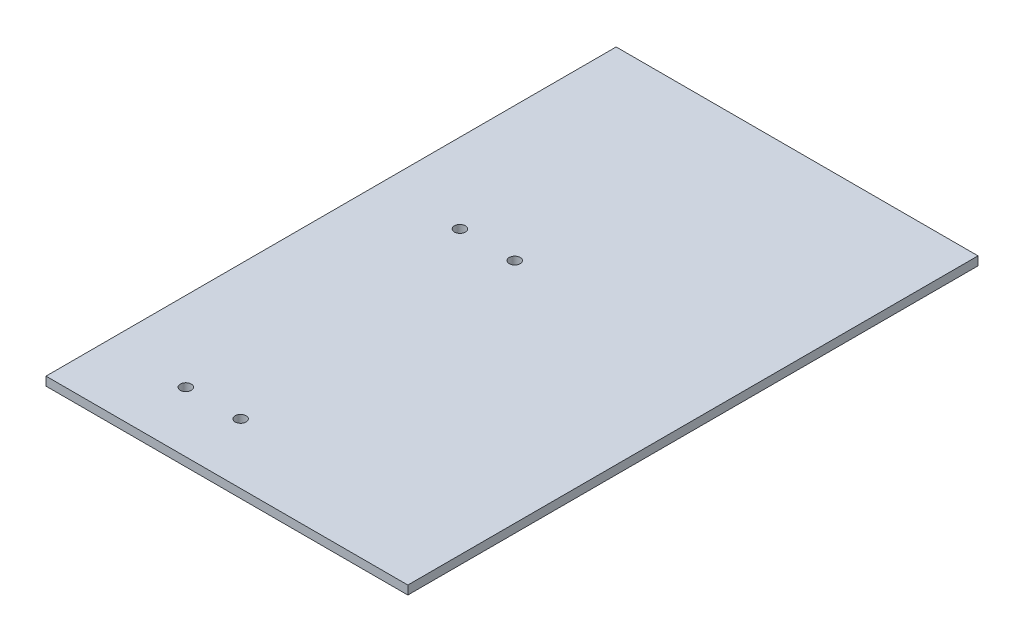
SolidWorks part; units mm, degrees
ref_plane "Plan de face" through (0, 0, 0) normal (0, 0, 1) x (1, 0, 0)
ref_plane "Plan de dessus" through (0, 0, 0) normal (0, 1, 0) x (1, 0, 0)
ref_plane "Plan de droite" through (0, 0, 0) normal (1, 0, 0) x (0, 0, -1)
sketch "Esquisse1" plane through (0, 0, 0) normal (0, 1, 0) x (1, 0, 0)
  line L1 (-33, -52) -> (33, -52)
  line L2 (-33, -52) -> (-33, 52)
  line L3 (-33, 52) -> (33, 52)
  line L4 (33, -52) -> (33, 52)
  line L5 (-33, -52) -> (33, 52) construction
  line L6 (-33, 52) -> (33, -52) construction
  point P0 (0, 0)
  dimension "D1" = 104
  dimension "D2" = 66
extrude "Boss.-Extru.1" add sketch "Esquisse1" along normal blind 1.5875
sketch "Esquisse2" plane through (-33, 0, 0) normal (-1, 0, 0) x (0, 0, 1)
  line L1 (-52, 0) -> (52, 0)
  line L2 (-52, 0) -> (-52, 4)
  line L3 (-52, 4) -> (52, 4)
  line L4 (52, 0) -> (52, 4)
  dimension "D1" = 4
  dimension "D2" = 104
extrude "Boss.-Extru.2" [suppressed] add sketch "Esquisse2" along normal blind 1.5875 contours L3 L4 L1 L2
sketch "Esquisse3" plane through (33, 0, 0) normal (1, 0, 0) x (0, 0, -1)
  line L1 (-52, 0) -> (52, 0)
  line L2 (-52, 0) -> (-52, 4)
  line L3 (-52, 4) -> (52, 4)
  line L4 (52, 0) -> (52, 4)
  dimension "D1" = 104
  dimension "D2" = 4
extrude "Boss.-Extru.3" [suppressed] add sketch "Esquisse3" along normal blind 1.5875
fillet "Congé2" [suppressed] radius 2
fillet "Congé3" [suppressed] radius 2
sketch "Esquisse4" plane through (0, 1.5875, 0) normal (0, 1, 0) x (1, 0, 0)
  line L0 (-33, 52) -> (-33, -52) construction
  line L1 (-8.5, -41) -> (-18.5, -41) construction
  line L2 (-8.5, -41) -> (-8.5, 9) construction
  line L3 (-8.5, 9) -> (-18.5, 9) construction
  line L4 (-18.5, -41) -> (-18.5, 9) construction
  line L6 (-33, -52) -> (33, -52) construction
  line L8 (-8.5, -41) -> (-18.5, 9) construction
  line L9 (-18.5, -41) -> (-8.5, 9) construction
  circle A0 centre (-18.5, 9) radius 1
  circle A1 centre (-8.5, 9) radius 1
  circle A2 centre (-8.5, -41) radius 1
  circle A3 centre (-18.5, -41) radius 1
  dimension "D5" = 2
  dimension "D1" = 50
  dimension "D2" = 10
  dimension "D3" = 14.5
  dimension "D4" = 11
extrude "Enlèv. mat.-Extru.1" cut sketch "Esquisse4" against normal blind 1.5875 contours A0 | A1 | A3 | A2
